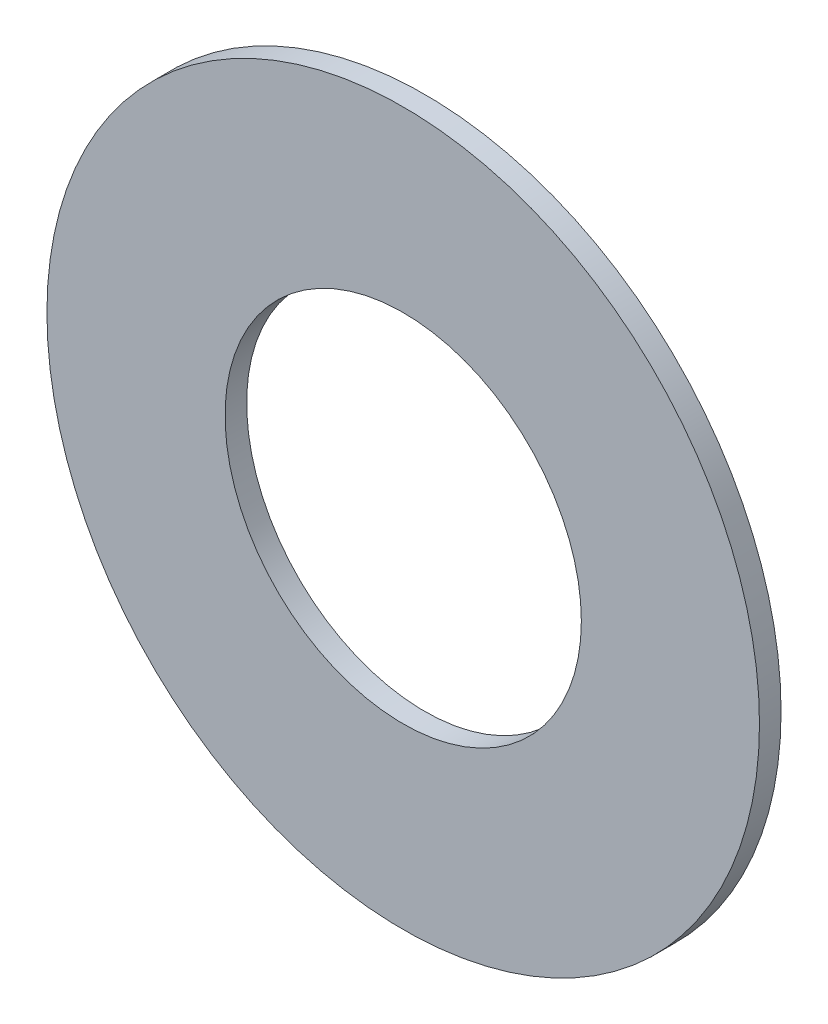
SolidWorks part; units mm, degrees
ref_plane "Plan1" through (0, 0, 0) normal (0, 0, 1) x (1, 0, 0)
ref_plane "Plan2" through (0, 0, 0) normal (0, 1, 0) x (1, 0, 0)
ref_plane "Plan3" through (0, 0, 0) normal (1, 0, 0) x (0, 0, -1)
sketch "Esquisse1" plane through (0, 0, 0) normal (0, 0, 1) x (1, 0, 0)
  circle A0 centre (0, 0) radius 33
  circle A1 centre (0, 0) radius 16.5
  dimension "D1" = 33
  dimension "D2" = 66
extrude "Base-Extrusion" add sketch "Esquisse1" along normal blind 2
